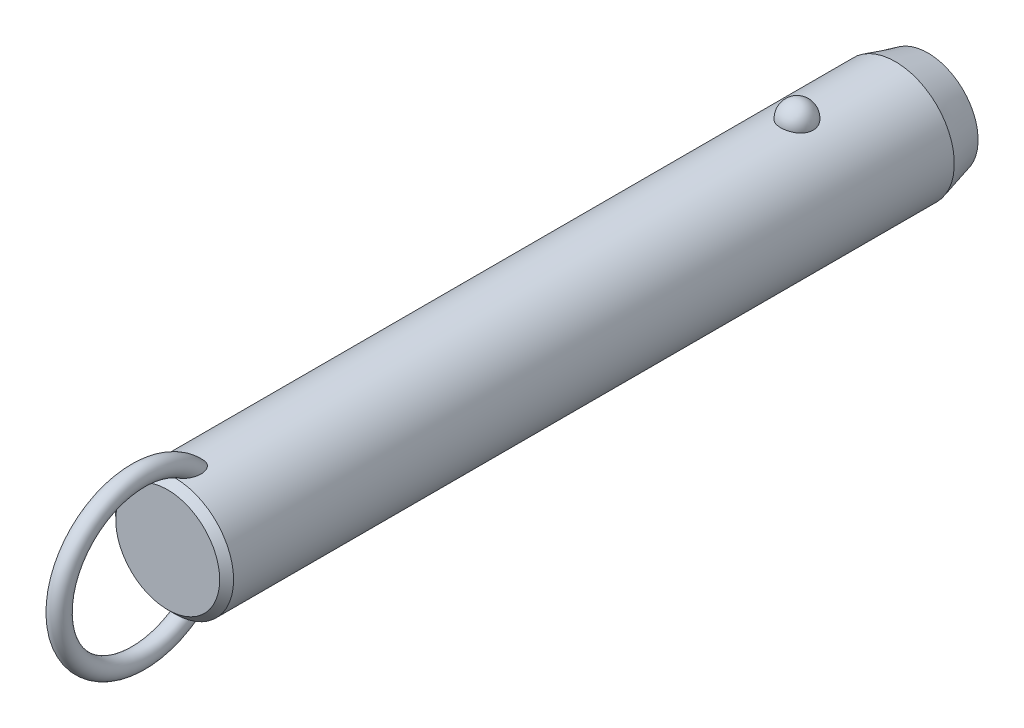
SolidWorks part; units mm, degrees
ref_plane "Front Plane" through (0, 0, 0) normal (0, 0, 1) x (1, 0, 0)
ref_plane "Top Plane" through (0, 0, 0) normal (0, 1, 0) x (1, 0, 0)
ref_plane "Right Plane" through (0, 0, 0) normal (1, 0, 0) x (0, 0, -1)
sketch "Sketch2" plane through (0, 0, 0) normal (0, 0, 1) x (1, 0, 0)
  circle A0 centre (0, 0) radius 12.7
  point P3 (0, 12.7)
  dimension "D1" = 25.4
extrude "Boss-Extrude1" add sketch "Sketch2" along normal blind 119.4
sketch "Sketch3" plane through (0, 0, 0) normal (0, 0, -1) x (-1, 0, 0)
  circle A0 centre (0, 0) radius 12.7
  dimension "D1" = 25.4
extrude "Boss-Extrude2" add sketch "Sketch3" along normal blind 31.7
chamfer "Chamfer1" distance 7 angle 15 1 edges at (-12.7, 0, -31.7)
sketch "Sketch12" plane through (0, 0, 0) normal (1, 0, 0) x (0, 0, -1)
  line L0 (-119.4, 12.7) -> (-119.4, -12.7) construction
  point P0 (-119.4, 0)
sketch "Sketch13" plane through (0, 0, 0) normal (1, 0, 0) x (0, 0, -1)
  circle A0 centre (-138.45, 0) radius 19.05
  point P2 (-119.4, 0)
  dimension "D1" = 38.1
sketch "Sketch14" plane through (0, 0, 0) normal (0, 1, 0) x (1, 0, 0)
  circle A0 centre (0, -121.4) radius 2
  point P2 (0, -119.4)
  dimension "D1" = 4
sweep "Sweep1" add profiles "Sketch14" path "Sketch13"
sketch "Sketch15" plane through (0, 0, 119.4) normal (0, 0, 1) x (1, 0, 0)
  circle A0 centre (0, 0) radius 12.7
  dimension "D1" = 25.4
extrude "Boss-Extrude3" add sketch "Sketch15" along normal blind 12.7
chamfer "Chamfer2" distance 1.5 angle 45 1 edges at (12.7, 0, 132.1)
sketch "Sketch18" plane through (0, 0, 0) normal (1, 0, 0) x (0, 0, -1)
  line L0 (24.7, 12.7) -> (-124.251, 12.7) construction
  line L1 (3.5, 16.2) -> (3.5, 9.2)
  line L2 (-124.251, -12.7) -> (24.7, -12.7) construction
  arc A0 (3.5, 16.2) -> (3.5, 9.2) centre (3.5, 12.7) ccw
  point P4 (0, 12.7)
  dimension "D1" = 28.9
revolve "Revolve1" add sketch "Sketch18" angle 360 about L1
